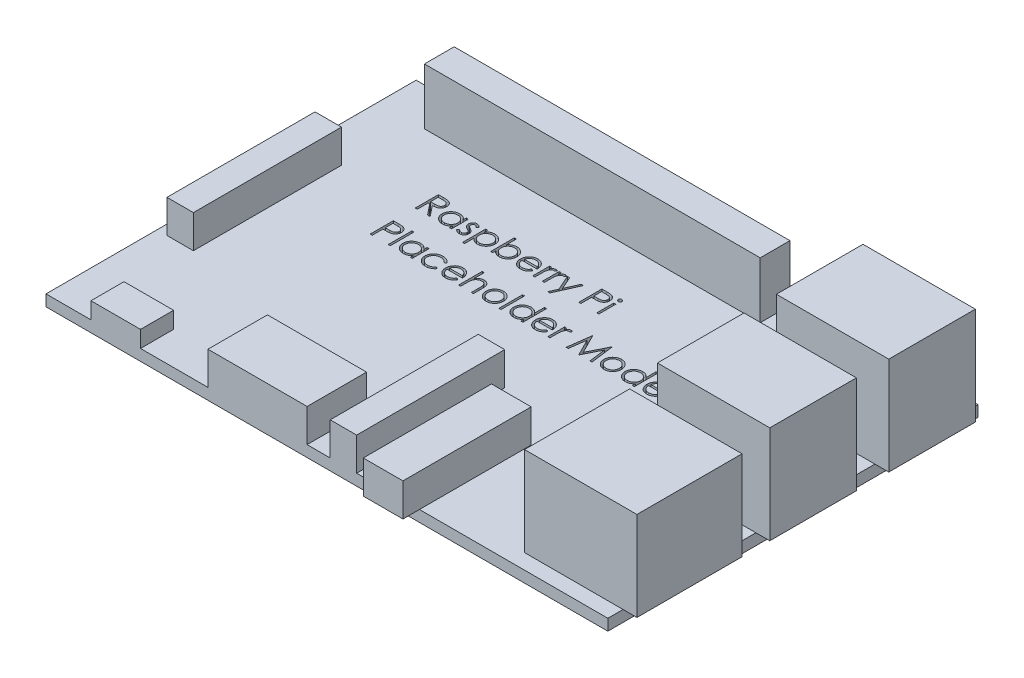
SolidWorks part; units mm, degrees
ref_plane "Front Plane" through (0, 0, 0) normal (0, 0, 1) x (1, 0, 0)
ref_plane "Top Plane" through (0, 0, 0) normal (0, 1, 0) x (1, 0, 0)
ref_plane "Right Plane" through (0, 0, 0) normal (1, 0, 0) x (0, 0, -1)
sketch "Sketch1" plane through (0, 0, 0) normal (0, 1, 0) x (1, 0, 0)
  line L1 (42.5, -28) -> (-42.5, -28)
  line L2 (42.5, -28) -> (42.5, 28)
  line L3 (42.5, 28) -> (-42.5, 28)
  line L4 (-42.5, -28) -> (-42.5, 28)
  line L5 (42.5, -28) -> (-42.5, 28) construction
  line L6 (42.5, 28) -> (-42.5, -28) construction
  point P0 (0, 0)
  dimension "D1" = 56
  dimension "D2" = 85
extrude "Boss-Extrude1" add sketch "Sketch1" along normal blind 1.7
sketch "Sketch2" plane through (0, 1.7, 0) normal (0, 1, 0) x (1, 0, 0)
  line L0 (42.5, 28) -> (-42.5, 28) construction
  line L1 (-35.5, 26.75) -> (15.3, 26.75)
  line L2 (-35.5, 26.75) -> (-35.5, 22.25)
  line L3 (-35.5, 22.25) -> (15.3, 22.25)
  line L4 (15.3, 26.75) -> (15.3, 22.25)
  line L5 (-35.5, 26.75) -> (15.3, 22.25) construction
  line L6 (-35.5, 22.25) -> (15.3, 26.75) construction
  line L7 (-42.5, 28) -> (-42.5, -28) construction
  point P0 (-10.1, 24.5)
  point P9 (0, 0)
  dimension "D1" = 50.8
  dimension "D2" = 3.5
  dimension "D3" = 7
  dimension "D4" = 4.5
extrude "Boss-Extrude2" add sketch "Sketch2" along normal blind 8.5
sketch "Sketch3" plane through (0, 1.7, 0) normal (0, 1, 0) x (1, 0, 0)
  line L0 (-42.5, 28) -> (-42.5, -28) construction
  line L1 (-37, -11.2) -> (-41, -11.2)
  line L2 (-37, -11.2) -> (-37, 11.2)
  line L3 (-37, 11.2) -> (-41, 11.2)
  line L4 (-41, -11.2) -> (-41, 11.2)
  line L5 (-37, -11.2) -> (-41, 11.2) construction
  line L6 (-37, 11.2) -> (-41, -11.2) construction
  line L7 (-42.5, -28) -> (42.5, -28) construction
  line L8 (0.5, -5.6) -> (4.5, -5.6)
  line L9 (0.5, -5.6) -> (0.5, -28)
  line L10 (0.5, -28) -> (4.5, -28)
  line L11 (4.5, -5.6) -> (4.5, -28)
  line L12 (0.5, -5.6) -> (4.5, -28) construction
  line L13 (0.5, -28) -> (4.5, -5.6) construction
  line L14 (42.5, 28) -> (-42.5, 28) construction
  line L15 (8, -11.1) -> (14, -11.1)
  line L16 (8, -11.1) -> (8, -30.5)
  line L17 (8, -30.5) -> (14, -30.5)
  line L18 (14, -11.1) -> (14, -30.5)
  line L19 (8, -11.1) -> (14, -30.5) construction
  line L20 (8, -30.5) -> (14, -11.1) construction
  line L21 (42.5, -28) -> (42.5, 28) construction
  line L22 (-18, -19) -> (-3, -19)
  line L23 (-18, -19) -> (-18, -28)
  line L24 (-18, -28) -> (-3, -28)
  line L25 (-3, -19) -> (-3, -28)
  point P0 (-39, 0)
  point P8 (2.5, -16.8)
  point P15 (11, -20.8)
  dimension "D1" = 4
  dimension "D2" = 1.5
  dimension "D3" = 22.4
  dimension "D4" = 22.4
  dimension "D5" = 4
  dimension "D6" = 43
  dimension "D7" = 58.5
  dimension "D8" = 6
  dimension "D9" = 16.9
  dimension "D10" = 11
  dimension "D11" = 28.5
  dimension "D12" = 15
  dimension "D13" = 9
extrude "Boss-Extrude3" add sketch "Sketch3" along normal blind 5
sketch "Sketch4" plane through (0, 1.7, 0) normal (0, 1, 0) x (1, 0, 0)
  line L0 (-42.5, -28) -> (-18, -28) construction
  line L1 (-28.2, -28) -> (-35.7, -28)
  line L2 (-28.2, -28) -> (-28.2, -23)
  line L3 (-28.2, -23) -> (-35.7, -23)
  line L4 (-35.7, -28) -> (-35.7, -23)
  line L5 (-18, -19) -> (-18, -28) construction
  dimension "D1" = 7.5
  dimension "D2" = 10.2
  dimension "D3" = 5
extrude "Boss-Extrude4" add sketch "Sketch4" along normal blind 2.5
sketch "Sketch5" plane through (0, 1.7, 0) normal (0, 1, 0) x (1, 0, 0)
  line L0 (42.5, 28) -> (-42.5, 28) construction
  line L1 (27.6, 25.5) -> (44.6, 25.5)
  line L2 (27.6, 25.5) -> (27.6, 12.4)
  line L3 (27.6, 12.4) -> (44.6, 12.4)
  line L4 (44.6, 25.5) -> (44.6, 12.4)
  line L5 (27.6, 7.5) -> (44.6, 7.5)
  line L6 (27.6, 7.5) -> (27.6, -5.6)
  line L7 (27.6, -5.6) -> (44.6, -5.6)
  line L8 (44.6, 7.5) -> (44.6, -5.6)
  line L9 (-42.5, 28) -> (-42.5, -28) construction
  dimension "D1" = 13.1
  dimension "D2" = 13.1
  dimension "D3" = 2.5
  dimension "D4" = 4.9
  dimension "D5" = 87.1
  dimension "D6" = 17
extrude "Boss-Extrude5" add sketch "Sketch5" along normal blind 14.8
sketch "Sketch6" plane through (0, 1.7, 0) normal (0, 1, 0) x (1, 0, 0)
  line L0 (27.6, -5.6) -> (27.6, -28) construction
  line L1 (14, -28) -> (42.5, -28) construction
  line L2 (44.6, -5.6) -> (44.6, -28) construction
  line L3 (44.6, -28) -> (42.5, -28) construction
  line L4 (27.6, -5.6) -> (44.6, -5.6) construction
  line L5 (27.6, -9.8) -> (44.6, -9.8)
  line L6 (27.6, -9.8) -> (27.6, -25.7)
  line L7 (27.6, -25.7) -> (44.6, -25.7)
  line L8 (44.6, -9.8) -> (44.6, -25.7)
  dimension "D1" = 15.9
  dimension "D2" = 4.2
extrude "Boss-Extrude6" add sketch "Sketch6" along normal blind 13.5
sketch "Sketch7" plane through (0, 1.7, 0) normal (0, 1, 0) x (1, 0, 0)
  text T0 "Raspberry Pi  Placeholder Model"
extrude "Cut-Extrude1" cut sketch "Sketch7" against normal blind 13.5
